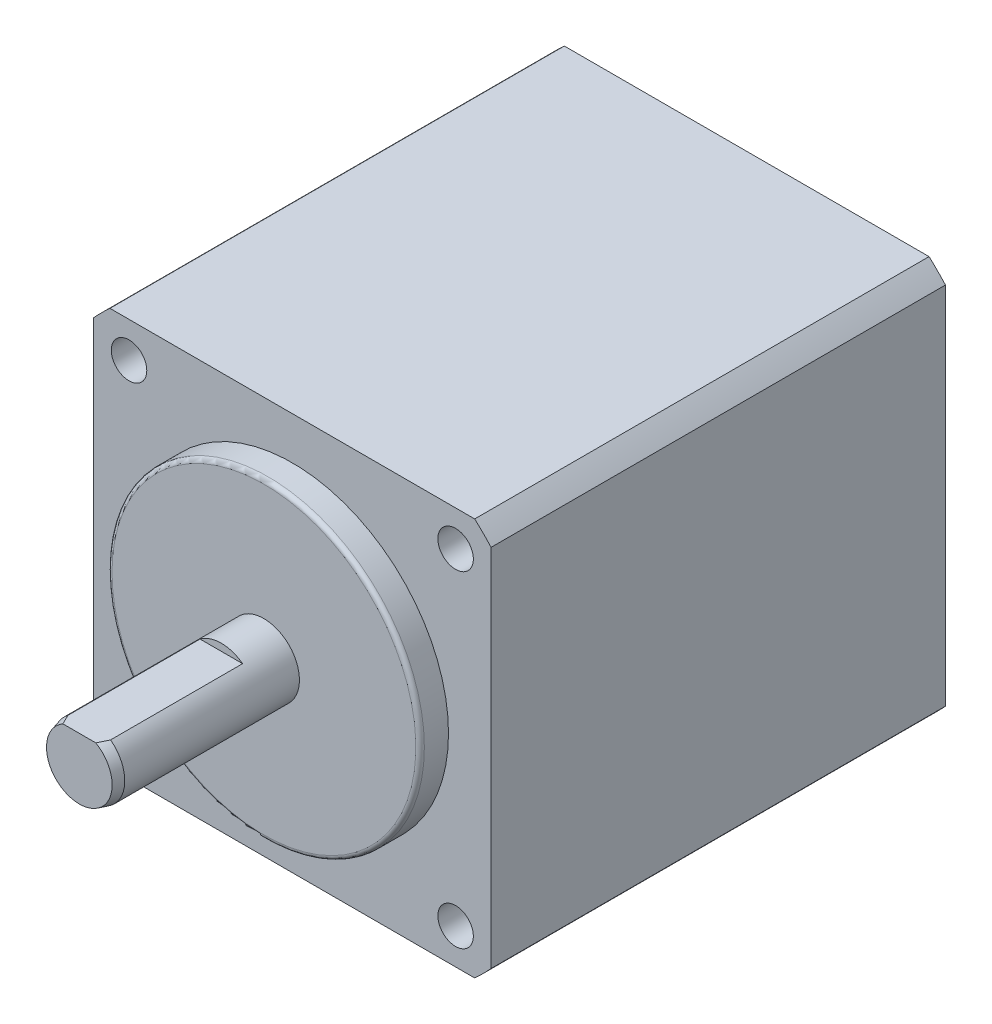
SolidWorks part; units mm, degrees
ref_plane "正面" through (0, 0, 0) normal (0, 0, 1) x (1, 0, 0)
ref_plane "平面" through (0, 0, 0) normal (0, 1, 0) x (1, 0, 0)
ref_plane "右側面" through (0, 0, 0) normal (1, 0, 0) x (0, 0, -1)
sketch "Sketch1" plane through (0, 0, 0) normal (0, 0, 1) x (1, 0, 0)
  circle A0 centre (0, 0) radius 2.5
  dimension "D1" = 5
extrude "Extrude1" add sketch "Sketch1" along normal blind 15
sketch "Sketch2" plane through (0, 0, 0) normal (0, 0, -1) x (-1, 0, 0)
  circle A0 centre (0, 0) radius 11
  dimension "D1" = 22
extrude "Extrude2" add sketch "Sketch2" against normal blind 2
sketch "Sketch3" plane through (0, 0, 0) normal (0, 0, -1) x (-1, 0, 0)
  line L1 (14, -14) -> (-14, -14)
  line L2 (14, -14) -> (14, 14)
  line L3 (14, 14) -> (-14, 14)
  line L4 (-14, -14) -> (-14, 14)
  line L5 (14, -14) -> (-14, 14) construction
  line L6 (14, 14) -> (-14, -14) construction
  circle A0 centre (0, 0) radius 19
  point P0 (0, 0)
  dimension "D3" = 38
  dimension "D1" = 28
  dimension "D2" = 28
extrude "Extrude3" add sketch "Sketch3" along normal blind 32 separate body contours L2 A0 L3 L4 L1 M1 | M1
sketch "Sketch4" plane through (0, -14, 0) normal (0, -1, 0) x (1, 0, 0)
  line L0 (-12.8452, -32) -> (12.8452, -32) construction
  line L1 (-7.6, -32) -> (7.6, -32)
  line L2 (-7.6, -32) -> (-7.6, -22.5)
  line L3 (-7.6, -22.5) -> (7.6, -22.5)
  line L4 (7.6, -32) -> (7.6, -22.5)
  dimension "D1" = 9.5
  dimension "D2" = 15.2
  dimension "D3" = 7.6
extrude "Extrude4" add sketch "Sketch4" along normal blind 5
sketch "Sketch5" plane through (0, 0, 15) normal (0, 0, 1) x (1, 0, 0)
  line L1 (-2.5379, 4.1995) -> (2.6225, 4.1995)
  line L2 (-2.5379, 4.1995) -> (-2.5379, 2)
  line L3 (-2.5379, 2) -> (2.6225, 2)
  line L4 (2.6225, 4.1995) -> (2.6225, 2)
  dimension "D1" = 2
extrude "Extrude5" cut sketch "Sketch5" against normal blind 10
chamfer "Chamfer1" distance 0.7 angle 15 1 edges at (0, -2.5, 15)
sketch "Sketch6" plane through (0, 0, 0) normal (0, 0, 1) x (1, 0, 0)
  line L1 (11.5, -11.5) -> (-11.5, -11.5) construction
  line L2 (11.5, -11.5) -> (11.5, 11.5) construction
  line L3 (11.5, 11.5) -> (-11.5, 11.5) construction
  line L4 (-11.5, -11.5) -> (-11.5, 11.5) construction
  line L5 (11.5, -11.5) -> (-11.5, 11.5) construction
  line L6 (11.5, 11.5) -> (-11.5, -11.5) construction
  circle A0 centre (-11.5, 11.5) radius 1.25
  circle A1 centre (11.5, 11.5) radius 1.25
  circle A2 centre (-11.5, -11.5) radius 1.25
  circle A3 centre (11.5, -11.5) radius 1.25
  point P0 (0, 0)
  dimension "D3" = 2.5
  dimension "D1" = 23
  dimension "D2" = 23
extrude "Extrude6" cut sketch "Sketch6" against normal blind 4.5
fillet "Fillet2" radius 0.3 1 edges at (-11, 0, 2)
